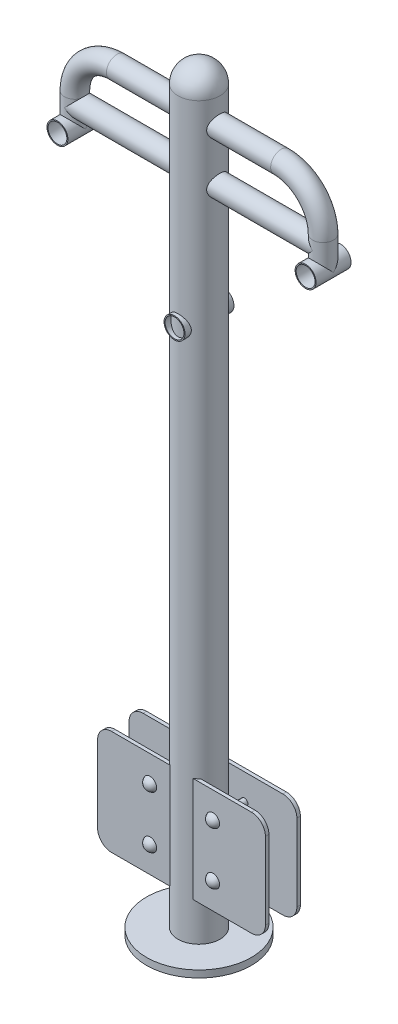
SolidWorks part; units mm, degrees
ref_plane "Plan de face" through (0, 0, 0) normal (0, 0, 1) x (1, 0, 0)
ref_plane "Plan de dessus" through (0, 0, 0) normal (0, 1, 0) x (1, 0, 0)
ref_plane "Plan de droite" through (0, 0, 0) normal (1, 0, 0) x (0, 0, -1)
sketch "Esquisse1" plane through (0, 0, 0) normal (0, 1, 0) x (1, 0, 0)
  circle A0 centre (0, 0) radius 150
  dimension "D1" = 300
extrude "Boss.-Extru.1" add sketch "Esquisse1" along normal blind 20
sketch "Esquisse2" plane through (0, 20, 0) normal (0, 1, 0) x (1, 0, 0)
  circle A0 centre (0, 0) radius 60
  dimension "D1" = 120
extrude "Boss.-Extru.2" add sketch "Esquisse2" along normal up to vertex
ref_plane "Plan1" through (0, 280, 0) normal (0, 1, 0) x (-1, 0, 0)
sketch "Esquisse3" plane through (0, 280, 0) normal (0, 1, 0) x (-1, 0, 0)
  line L0 (-44.7214, -40) -> (-240, -40)
  line L1 (240, -50) -> (33.1662, -50)
  line L2 (240, -50) -> (240, -40)
  line L3 (240, -40) -> (44.7214, -40)
  line L4 (-240, -50) -> (-240, -40)
  line L5 (-33.1662, -50) -> (-240, -50)
  circle A0 centre (0, 0) radius 60 construction
  arc A1 (33.1662, -50) -> (44.7214, -40) centre (0, 0) ccw
  arc A2 (-44.7214, -40) -> (-33.1662, -50) centre (0, 0) ccw
  dimension "D1" = 240
  dimension "D2" = 10
  dimension "D3" = 40
extrude "Boss.-Extru.3" add sketch "Esquisse3" along normal mid plane 300
fillet "Congé1" radius 40 4 edges at (240, 430, -45) (240, 130, -45) (-240, 130, -45) (-240, 430, -45)
mirror "Symétrie1" about plane through (0, 0, 0) normal (0, 0, 1) of "Congé1", "Boss.-Extru.3"
sketch "Esquisse4" plane through (0, 0, -50) normal (0, 0, -1) x (-1, 0, 0)
  circle A0 centre (-90, 355) radius 10
  circle A1 centre (-90, 205) radius 10
  circle A2 centre (90, 205) radius 10
  circle A3 centre (90, 355) radius 10
  dimension "D2" = 20
extrude "Enlèv. mat.-Extru.1" cut sketch "Esquisse4" against normal through all
sketch "Esquisse5" plane through (0, 0, 0) normal (0, 0, 1) x (1, 0, 0)
  line L0 (0, 1939.4506) -> (0, 1770.0054) construction
  line L1 (0, 0) -> (0, 2110) construction
  circle A0 centre (-355, 1835) radius 30
  circle A1 centre (355, 1835) radius 30
  dimension "D1" = 60
extrude "Boss.-Extru.4" add sketch "Esquisse5" along normal mid plane 100 separate body
sketch "Esquisse6" plane through (0, 0, 0) normal (0, 0, 1) x (1, 0, 0)
  line L0 (0, 2035) -> (-235, 2035)
  line L1 (-355, 1915) -> (-355, 1835)
  line L2 (0, -165) -> (0, 165) construction
  arc A0 (-235, 2035) -> (-355, 1915) centre (-235, 1915) ccw
sketch "Esquisse7" plane through (0, 0, 0) normal (1, 0, 0) x (0, 0, -1)
  circle A0 centre (0, 2035) radius 30
  circle A1 centre (0, 2035) radius 27
  dimension "D1" = 60
  dimension "D2" = 3
sweep "Balayage2" add profiles "Esquisse7" path "Esquisse6"
sketch "Esquisse8" plane through (0, 0, 0) normal (1, 0, 0) x (0, 0, -1)
  circle A0 centre (0, 1888) radius 30
  circle A2 centre (0, 1888) radius 27
  dimension "D1" = 60
  dimension "D2" = 3
extrude "Boss.-Extru.5" add sketch "Esquisse8" against normal up to surface (355 mm away)
mirror "Symétrie2" about plane through (0, 0, 0) normal (1, 0, 0) of "Boss.-Extru.5", "Balayage2"
sketch "Esquisse9" plane through (0, 0, 50) normal (0, 0, 1) x (1, 0, 0)
  circle A0 centre (-355, 1835) radius 27
  circle A1 centre (-355, 1835) radius 30 construction
  circle A2 centre (355, 1835) radius 27
  dimension "D1" = 3
extrude "Enlèv. mat.-Extru.2" cut sketch "Esquisse9" against normal through all
sketch "Esquisse10" plane through (0, 0, 0) normal (0, 0, 1) x (1, 0, 0)
  circle A0 centre (0, 1540) radius 30
  circle A1 centre (0, 1540) radius 27
  dimension "D1" = 60
  dimension "D2" = 3
extrude "Boss.-Extru.6" add sketch "Esquisse10" along normal mid plane 140
sketch "Esquisse11" plane through (0, 2110, 0) normal (0, 1, 0) x (1, 0, 0)
  circle A0 centre (0, 0) radius 57
  circle A1 centre (0, 0) radius 60 construction
  dimension "D1" = 3
extrude "Enlèv. mat.-Extru.3" cut sketch "Esquisse11" against normal up to surface (2090 mm away)
ref_plane "Plan2" through (-90, 0, 0) normal (1, 0, 0) x (0, 0, -1)
sketch "Esquisse12" plane through (-90, 0, 0) normal (1, 0, 0) x (0, 0, -1)
  line L0 (-71.37, 355) -> (81.7333, 355) construction
  line L1 (50, 365) -> (40, 365) construction
  line L2 (40, 345) -> (50, 345) construction
  line L3 (50, 365) -> (-50, 365)
  line L4 (50, 390) -> (50, 170) construction
  line L5 (-50, 390) -> (-50, 170) construction
  line L6 (-50, 365) -> (-50, 373.735)
  line L7 (50, 365) -> (50, 373.735)
  line L8 (63, 355) -> (-63, 355)
  line L14 (0, 365) -> (0, 338.9496) construction
  arc A0 (50, 373.735) -> (63, 355) centre (43, 355) cw
  arc A1 (-63, 355) -> (-50, 373.735) centre (-43, 355) cw
  dimension "D1" = 20
  dimension "D2" = 7
revolve "Révolution1" add sketch "Esquisse12" angle 360 about L0
pattern_linear "Répétition linéaire1" count 2 spacing 180 along (1, 0, 0) count 2 spacing 150 along (0, -1, 0) of "Révolution1"
sketch "Esquisse13" plane through (0, 0, 0) normal (0, 0, 1) x (1, 0, 0)
  line L0 (0, 2110) -> (0, 2184.7142) construction
  line L1 (60, 2110) -> (-60, 2110) construction
  line L2 (0, 2110) -> (-60, 2110)
  line L3 (0, 2170) -> (0, 2110)
  arc A0 (-60, 2110) -> (0, 2170) centre (0, 2110) cw
revolve "Révolution2" add sketch "Esquisse13" angle 360 about L0
